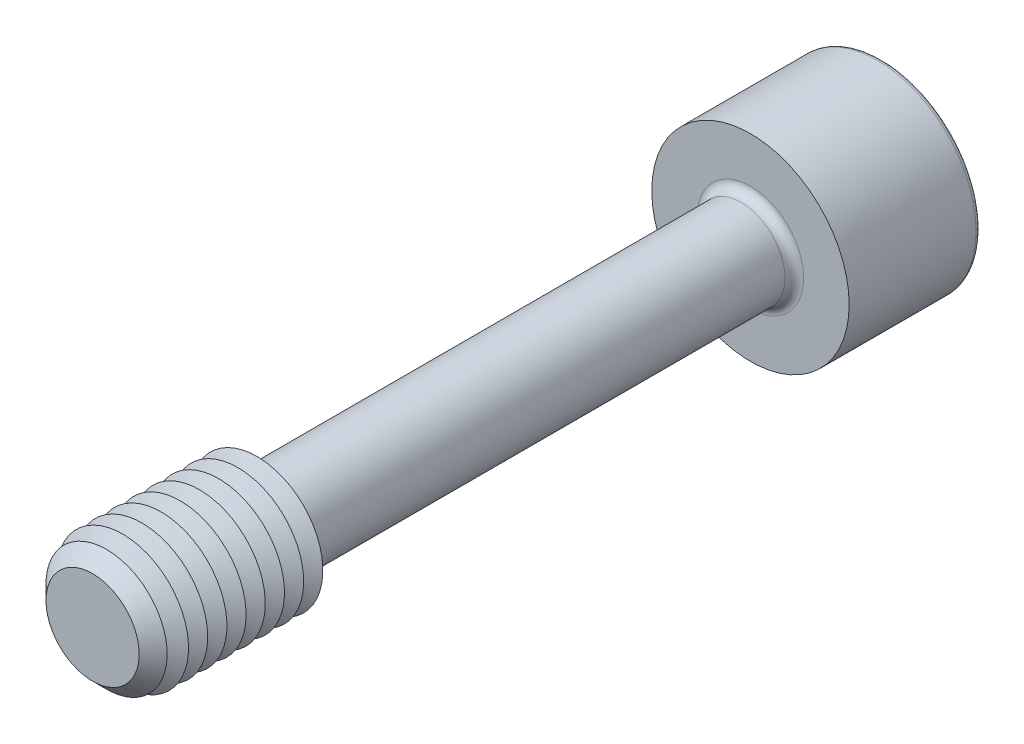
SolidWorks part; units mm, degrees
ref_plane "Front Plane" through (0, 0, 0) normal (0, 0, 1) x (1, 0, 0)
ref_plane "Top Plane" through (0, 0, 0) normal (0, 1, 0) x (1, 0, 0)
ref_plane "Right Plane" through (0, 0, 0) normal (1, 0, 0) x (0, 0, -1)
sketch "Sketch1" plane through (0, 0, 0) normal (0, 0, 1) x (1, 0, 0)
  circle A0 centre (0, 0) radius 4
  dimension "D1" = 8
extrude "Extrude1" add sketch "Sketch1" along normal mid plane 60
sketch "Sketch2" plane through (0, 0, 0) normal (1, 0, 0) x (0, 0, -1)
  line L0 (-30, 0) -> (-30, 6)
  line L1 (-30, 4) -> (-30, -4) construction
  line L2 (-30, 6) -> (-15, 6)
  line L3 (-15, 6) -> (-13.8453, 4)
  line L4 (30, 4) -> (-30, 4) construction
  line L5 (-13.8453, 4) -> (-13.8453, 0)
  line L6 (-13.8453, 0) -> (-30, 0)
  dimension "D1" = 6
  dimension "D2" = 120
  dimension "D3" = 15
revolve "Revolve1" add sketch "Sketch2" angle 360 about L6
chamfer "Chamfer1" distance 1.75 angle 45 1 edges at (0, 6, 30)
sketch "Sketch3" plane through (0, 0, -30) normal (0, 0, -1) x (-1, 0, 0)
  circle A0 centre (0, 0) radius 9
  dimension "D1" = 18
extrude "Extrude2" add sketch "Sketch3" along normal blind 12
sketch "Sketch4" plane through (-13.7, 0, -42) normal (0, 0, 1) x (1, 0, 0)
  line L2 (10.8132, -5) -> (16.5868, -5)
  line L3 (16.5868, -5) -> (19.4735, 0)
  line L4 (19.4735, 0) -> (16.5868, 5)
  line L6 (16.5868, 5) -> (10.8132, 5)
  line L7 (10.8132, 5) -> (7.9265, 0)
  line L8 (7.9265, 0) -> (10.8132, -5)
  circle A0 centre (13.7, 0) radius 5 construction
  dimension "D1" = 10
extrude "Extrude3" cut sketch "Sketch4" along normal blind 10
fillet "Fillet1" radius 0.85 1 edges at (-4, 0, -30)
fillet "Fillet2" radius 0.425 1 edges at (-9, 0, -42)
sketch "Sketch5" plane through (0, 0, 0) normal (1, 0, 0) x (0, 0, -1)
  line L0 (32, 0) -> (32, -5)
  line L1 (32, -5) -> (29.1132, 0)
  line L2 (29.1132, 0) -> (32, 0)
  dimension "D1" = 30
revolve "Cut-Revolve1" cut sketch "Sketch5" angle 360 about L2
sketch "Sketch6" plane through (0, 0, 0) normal (1, 0, 0) x (0, 0, -1)
  line L0 (1.332, 0) -> (-13.289, 0) construction
sketch "Sketch7" plane through (0, 0, 0) normal (1, 0, 0) x (0, 0, -1)
  line L0 (-15, 6) -> (-15.875, 4.4845)
  line L1 (-15.875, 4.4845) -> (-16.75, 6)
  line L2 (-15, 6) -> (-28.25, 6) construction
  line L3 (-16.75, 6) -> (-15, 6)
  dimension "D1" = 1.75
revolve "Cut-Revolve2" cut sketch "Sketch7" angle 360 about L0
pattern_linear "LPattern1" count 8 spacing 1.75 along (0, 0, 1) of "Cut-Revolve2"
